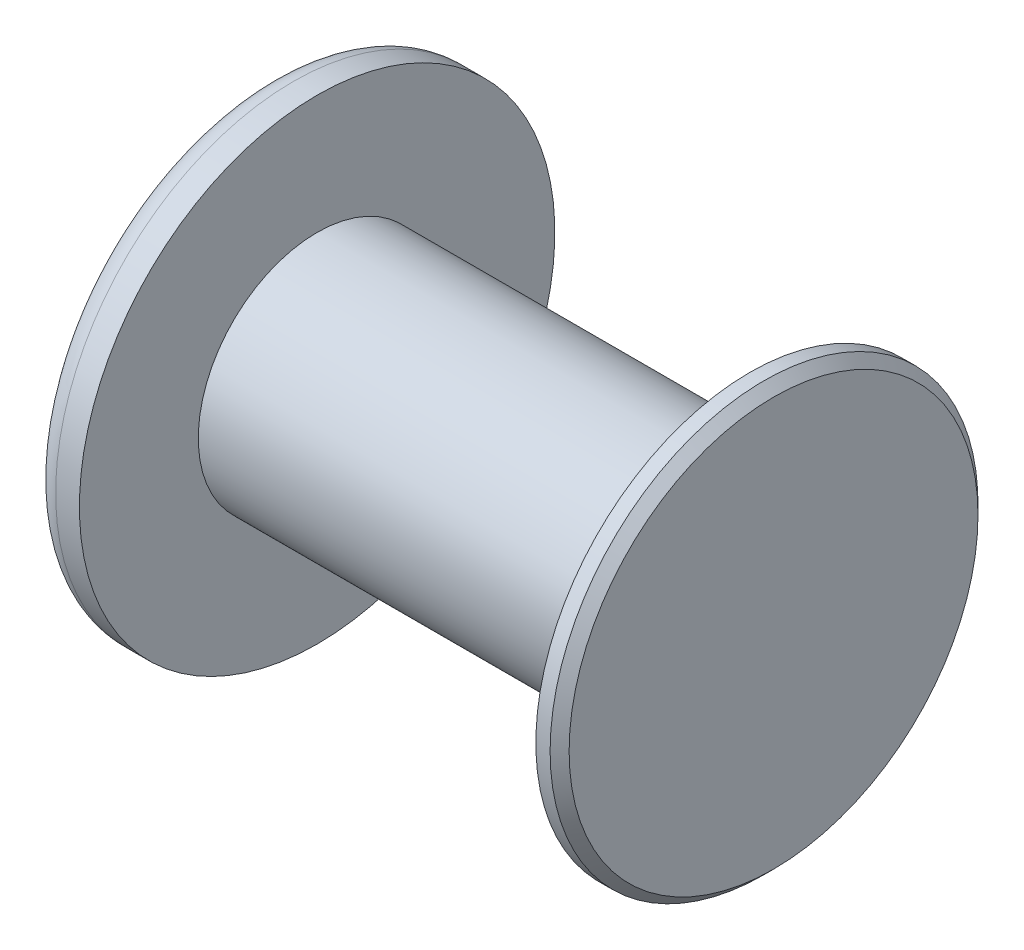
SolidWorks part; units mm, degrees
ref_plane "Plan de face" through (0, 0, 0) normal (0, 0, 1) x (1, 0, 0)
ref_plane "Plan de dessus" through (0, 0, 0) normal (0, 1, 0) x (1, 0, 0)
ref_plane "Plan de droite" through (0, 0, 0) normal (1, 0, 0) x (0, 0, -1)
sketch "Esquisse1" plane through (0, 0, 0) normal (0, 0, 1) x (1, 0, 0)
  line L0 (-5.3, 0) -> (5.3, 0) construction
  line L1 (-5.3, 0) -> (-5.3, 5)
  line L2 (-5.3, 5) -> (-4.3, 5)
  line L3 (-4.3, 5) -> (-4.3, 2.5)
  line L4 (-4.3, 2.5) -> (4.8, 2.5)
  line L5 (4.8, 2.5) -> (4.8, 4.5)
  line L6 (4.8, 4.5) -> (5.3, 4.5)
  line L7 (5.3, 4.5) -> (5.3, 0)
  line L8 (5.3, 0) -> (-5.3, 0)
  point P4 (0, 0)
  dimension "D1" = 9.1
  dimension "D2" = 1
  dimension "D3" = 0.5
  dimension "D4" = 2.5
  dimension "D5" = 4.5
  dimension "D6" = 5
revolve "Révolution1" add sketch "Esquisse1" angle 360 about L0
fillet "Congé1" radius 0.5 1 edges at (-5.3, -5, 0)
chamfer "Chanfrein1" distance 0.2 angle 45 1 edges at (5.3, -4.5, 0)
